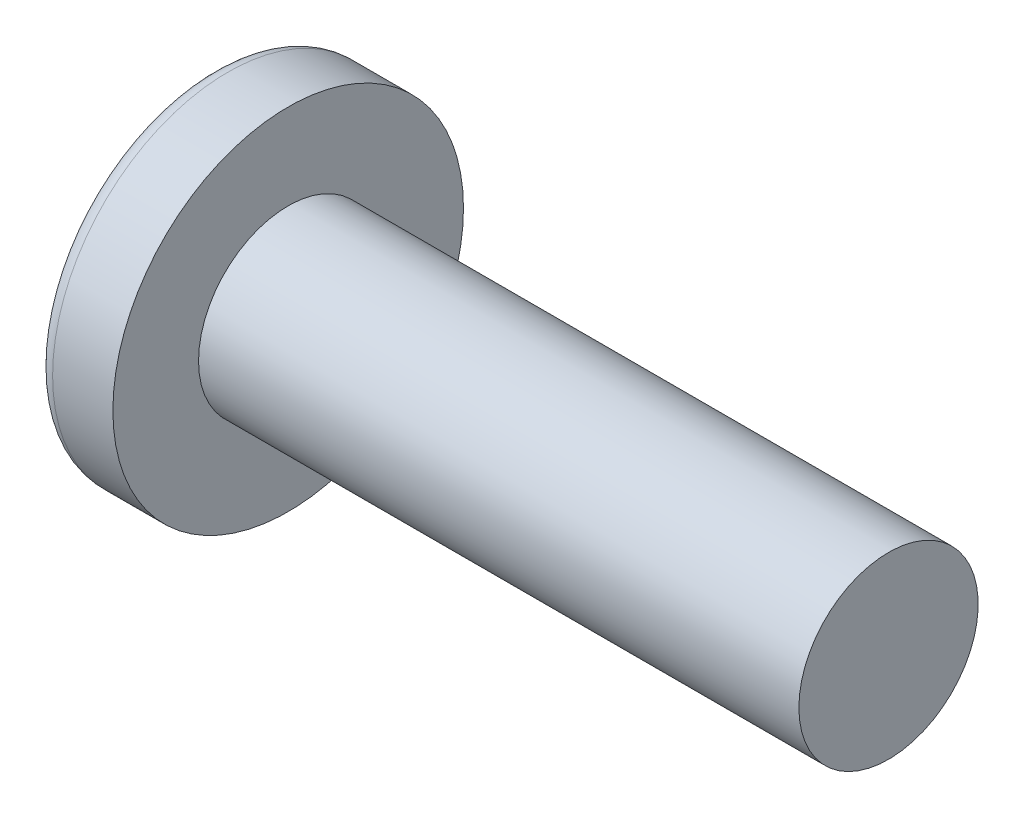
SolidWorks part; units mm, degrees
ref_plane "Plane1" through (0, 0, 0) normal (0, 0, 1) x (1, 0, 0)
ref_plane "Plane2" through (0, 0, 0) normal (0, 1, 0) x (1, 0, 0)
ref_plane "Plane3" through (0, 0, 0) normal (1, 0, 0) x (0, 0, -1)
sketch "BodySke" plane through (0, 0, 0) normal (0, 0, 1) x (1, 0, 0)
  line L0 (2.032, 1.4224) -> (2.032, 2.7813)
  line L1 (2.3495, 6.35) -> (2.3495, -3.175) construction
  line L2 (-25.4, 0) -> (127, 0) construction
  line L3 (11.557, 0) -> (0, 0)
  line L4 (2.032, 1.4224) -> (11.557, 1.4224)
  line L5 (11.557, 1.4224) -> (11.557, 0)
  line L6 (1.0756, 2.7813) -> (2.032, 2.7813)
  line L7 (2.032, -1.4224) -> (11.557, -1.4224) construction
  line L8 (2.032, 6.35) -> (2.032, -3.175) construction
  arc A0 (0.8702, 2.6767) -> (0, 0) centre (4.5517, 0) ccw
  arc A2 (0.8702, 2.6767) -> (1.0756, 2.7813) centre (1.0756, 2.5273) cw
  dimension "Head_fillet_rad" = 0.254
  dimension "Head_crown_rad" = 4.5517
  dimension "Head_ht" = 2.032
  dimension "Diameter" = 2.8448
  dimension "Length" = 9.525
  dimension "Head_dia" = 5.5626
  dimension "Advance" = 0.635
  dimension "Thread_nom" = 9.525
revolve "Base-Revolve" add sketch "BodySke" angle 360 about L2
sketch "Sketch3" plane through (0, 0, 0) normal (1, 0, 0) x (0, 0, -1)
  line L0 (0.4064, -1.8161) -> (-0.4064, -1.8161)
  line L1 (0.4064, -1.8161) -> (0.4064, 1.8161)
  line L2 (-0.4064, 1.8161) -> (0.4064, 1.8161)
  line L3 (-0.4064, 1.8161) -> (-0.4064, -1.8161)
  dimension "D1" = 1.8161
  dimension "Cross_dia" = 3.6322
  dimension "D2" = 0.4064
  dimension "Cross_width" = 0.8128
ref_plane "Plane4" through (2.0066, 0, 0) normal (1, 0, 0) x (0, 0, -1)
sketch "Sketch4" plane through (2.0066, 0, 0) normal (1, 0, 0) x (0, 0, -1)
  line L0 (0.2032, -0.2032) -> (-0.2032, -0.2032)
  line L1 (0.2032, -0.2032) -> (0.2032, 0.2032)
  line L2 (-0.2032, 0.2032) -> (0.2032, 0.2032)
  line L3 (-0.2032, 0.2032) -> (-0.2032, -0.2032)
  dimension "D1" = 0.4064
  dimension "D2" = 0.4064
  dimension "D3" = 0.2032
  dimension "D4" = 0.2032
loft "Cut-Loft1" cut profiles "Sketch3", "Sketch4"
pattern_circular "CirPattern1" count 2 every 90 about axis through (0, 0, 0) along (1, 0, 0) of "Cut-Loft1"
sketch "ThdSchSke" plane through (0, 0, 0) normal (0, 0, 1) x (1, 0, 0)
  line L0 (2.667, -1.0439) -> (2.402, -1.4224)
  line L1 (2.667, -1.0439) -> (2.932, -1.4224)
  line L2 (2.932, -1.4224) -> (2.932, -1.778)
  line L3 (-3.175, 0) -> (5.1513, 0) construction
  line L5 (2.932, -1.778) -> (2.402, -1.778)
  line L6 (2.402, -1.778) -> (2.402, -1.4224)
  dimension "Thread_minor" = 2.0879
  dimension "Diameter" = 2.8448
  dimension "Start" = 2.667
  dimension "SideAngle" = 55
  dimension "VeeAngle" = 70
  dimension "Overcut" = 3.556
revolve "ThreadSchematic" [suppressed] cut sketch "ThdSchSke" angle 360 about L3
pattern_linear "ThdSchPat" [suppressed]
equation "\"D1@Sketch3\" = \"Cross_dia@Sketch3\" / 2"
equation "\"D2@Sketch3\" = \"Cross_width@Sketch3\" / 2"
equation "\"D1@Sketch4\" = \"Cross_width@Sketch3\" *.5"
equation "\"D2@Sketch4\" = \"D1@Sketch4\""
equation "\"D3@Sketch4\" = \"D1@Sketch4\" / 2"
equation "\"D4@Sketch4\" = \"D2@Sketch4\" / 2"
equation "\"Thread_length@ThreadCosmetic\" = ((sgn( (\"Length@BodySke\" - \"Advance@BodySke\" ) - \"Thread_nom@BodySke\" )-1)*( (\"Length@BodySke\" - \"Advance@BodySke\" ) - \"Thread_nom@BodySke\" ))/-2+ \"Thread_nom@BodySke\""
equation "\"Thread_minor@ThdSchSke\" = \"Thread_minor@ThreadCosmetic\""
equation "\"Diameter@ThdSchSke\" = \"Diameter@BodySke\""
equation "\"Overcut@ThdSchSke\" = \"Diameter@BodySke\" * 1.25"
equation "\"Start@ThdSchSke\" = \"Head_ht@BodySke\" + \"Length@BodySke\" - \"Thread_length@ThreadCosmetic\"  '---Non-countersunk---"
equation "\"Num_threads@ThdSchPat\" = int( \"Thread_length@ThreadCosmetic\" / \"Advance@BodySke\" + 0.999 )  + 1"
equation "\"Advance@ThdSchPat\" = \"Thread_length@ThreadCosmetic\" /  (\"Num_threads@ThdSchPat\" - 1) 'relax it"
